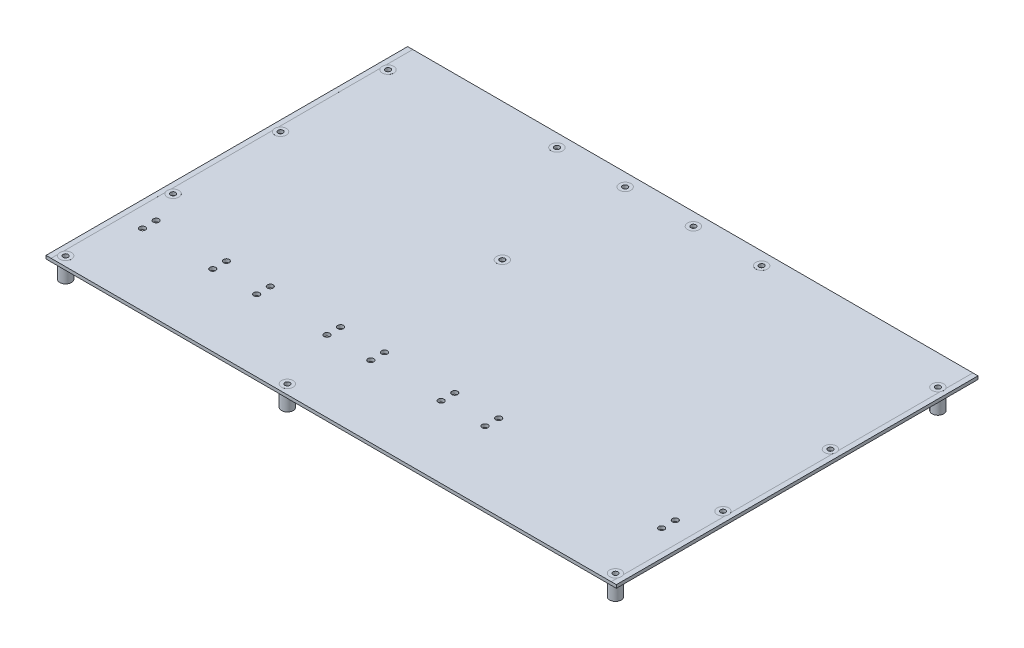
SolidWorks part; units mm, degrees
ref_plane "Front Plane" through (0, 0, 0) normal (0, 0, 1) x (1, 0, 0)
ref_plane "Top Plane" through (0, 0, 0) normal (0, 1, 0) x (1, 0, 0)
ref_plane "Right Plane" through (0, 0, 0) normal (1, 0, 0) x (0, 0, -1)
imported_body "Imported1"
sketch "Sketch1" plane through (0, -0.0127, 0) normal (0, -1, 0) x (1, 0, 0)
  circle A0 centre (165.1, 22.225) radius 1.905 construction
  circle A1 centre (165.1, 22.225) radius 4.318 construction
  circle A2 centre (165.1, 22.225) radius 1.905
  circle A3 centre (165.1, 22.225) radius 4.318
  circle A4 centre (-165.1, 22.225) radius 1.905 construction
  circle A5 centre (-165.1, 22.225) radius 4.318 construction
  circle A6 centre (-165.1, 22.225) radius 1.905
  circle A7 centre (-165.1, 22.225) radius 4.318
  circle A8 centre (-165.1, 262.255) radius 1.905 construction
  circle A9 centre (-165.1, 262.255) radius 4.318 construction
  circle A10 centre (-165.1, 262.255) radius 1.905
  circle A11 centre (-165.1, 262.255) radius 4.318
  circle A12 centre (165.1, 262.255) radius 1.905 construction
  circle A13 centre (165.1, 262.255) radius 4.318 construction
  circle A14 centre (165.1, 262.255) radius 1.905
  circle A15 centre (165.1, 262.255) radius 4.318
  circle A16 centre (-1.27, 9.525) radius 1.905 construction
  circle A17 centre (-1.27, 9.525) radius 4.318 construction
  circle A18 centre (-1.27, 9.525) radius 1.905
  circle A19 centre (-1.27, 9.525) radius 4.318
  circle A20 centre (0, 262.255) radius 1.905 construction
  circle A21 centre (0, 262.255) radius 4.318 construction
  circle A22 centre (0, 262.255) radius 1.905
  circle A23 centre (0, 262.255) radius 4.318
extrude "Extrude1" add sketch "Sketch1" along normal blind 12.7
sketch "Sketch2" plane through (0, 2.3622, 0) normal (0, 1, 0) x (-1, 0, 0)
  line L0 (-132.7089, -35.0186) -> (-132.7089, 350.451)
extrude "Cut-Extrude-Thin1" cut sketch "Sketch2" against normal through all and the other way through all thin
move or copy body "Body-Move/Copy1" bodies to move or copy 104 copy no translate (79.1672, 0, 0)
sketch "Sketch3" plane through (130.1689, 0, 0) normal (1, 0, 0) x (0, 0, -1)
  line L4 (-269.24, 0) -> (0, 0)
  line L5 (0, 0) -> (0, 2.3622)
  line L6 (0, 2.3622) -> (-269.24, 2.3622)
  line L7 (-269.24, 2.3622) -> (-269.24, 0)
  line L8 (-269.24, 0) -> (0, 0)
  line L9 (0, 0) -> (0, 2.3622)
  line L10 (0, 2.3622) -> (-269.24, 2.3622)
  line L11 (-269.24, 2.3622) -> (-269.24, 0)
  dimension "D1" = 0
extrude "Extrude2" add sketch "Sketch3" along normal up to vertex
